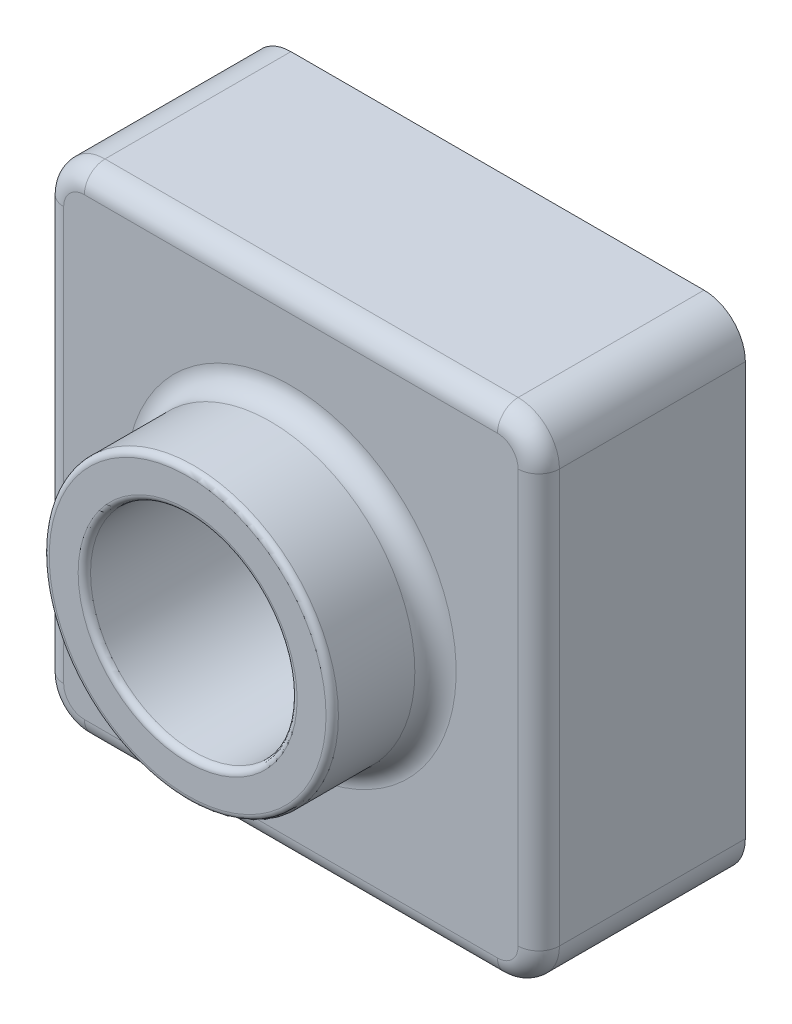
SolidWorks part; units mm, degrees
ref_plane "Front Plane" through (0, 0, 0) normal (0, 0, 1) x (1, 0, 0)
ref_plane "Top Plane" through (0, 0, 0) normal (0, 1, 0) x (1, 0, 0)
ref_plane "Right Plane" through (0, 0, 0) normal (1, 0, 0) x (0, 0, -1)
sketch "Sketch2" plane through (0, 0, 0) normal (0, 0, 1) x (1, 0, 0)
  line L1 (0, 0) -> (120, 0)
  line L2 (0, 0) -> (0, 120)
  line L3 (0, 120) -> (120, 120)
  line L4 (120, 0) -> (120, 120)
  dimension "D1" = 120
  dimension "D2" = 120
extrude "Boss-Extrude1" add sketch "Sketch2" along normal blind 50
sketch "Sketch4" plane through (0, 0, 50) normal (0, 0, 1) x (1, 0, 0)
  line L0 (120, 120) -> (0, 120) construction
  line L1 (0, 120) -> (0, 0) construction
  circle A0 centre (60, 60) radius 35
  dimension "D1" = 60
  dimension "D3" = 70
  dimension "D2" = 60
extrude "Boss-Extrude2" add sketch "Sketch4" along normal blind 25
sketch "Sketch6" plane through (0, 0, 75) normal (0, 0, 1) x (1, 0, 0)
  circle A0 centre (60, 60) radius 25
  dimension "D1" = 50
extrude "Cut-Extrude1" cut sketch "Sketch6" against normal through all
fillet "Fillet1" radius 10 4 edges at (0, 0, 25) (120, 0, 25) (120, 120, 25) (0, 120, 25)
fillet "Fillet2" radius 1.5 2 edges at (95, 60, 75) (85, 60, 75)
fillet "Fillet3" radius 5 9 edges at (25, 60, 50) (2.9289, 117.0711, 50) (60, 120, 50) (117.0711, 117.0711, 50) (120, 60, 50) (117.0711, 2.9289, 50) (60, 0, 50) (2.9289, 2.9289, 50) (0, 60, 50)
shell "Shell1" thickness 2
